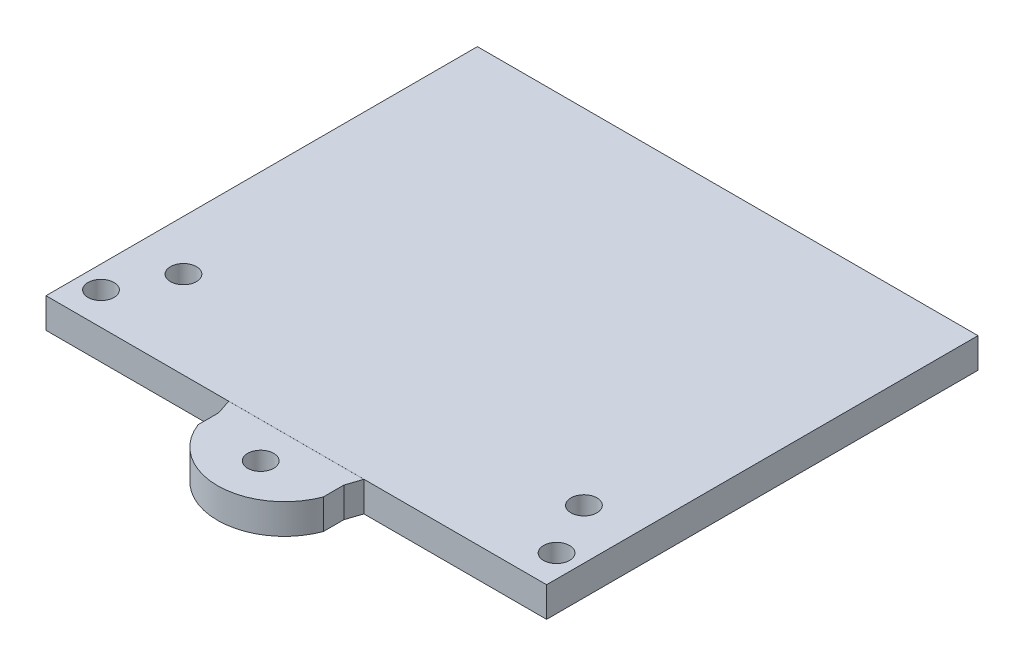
SolidWorks part; units mm, degrees
ref_plane "Front Plane" through (0, 0, 0) normal (0, 0, 1) x (1, 0, 0)
ref_plane "Top Plane" through (0, 0, 0) normal (0, 1, 0) x (1, 0, 0)
ref_plane "Right Plane" through (0, 0, 0) normal (1, 0, 0) x (0, 0, -1)
sketch "Sketch1" plane through (0, 0, 0) normal (0, 1, 0) x (1, 0, 0)
  line L0 (0, 3000) -> (0, -3000)
  line L1 (-50000, -172520.0043) -> (50000, -172520.0043)
  line L2 (-50000, -172520.0043) -> (-50000, -285980.011)
  line L3 (-50000, -285980.011) -> (50000, -285980.011)
  line L4 (50000, -172520.0043) -> (50000, -285980.011)
  line L5 (0, 3000) -> (0, -3000)
extrude "Boss-Extrude2" add sketch "Sketch1" against normal blind 6000 separate body contours L1 L4 L3 L2
ref_plane "Plane2" through (0, -6010, 0) normal (0, -1, 0) x (-1, 0, 0)
sketch "Sketch4" plane through (0, -6010, 0) normal (0, -1, 0) x (-1, 0, 0)
  line L0 (12500, -288980.011) -> (13500, -285980.011)
  line L2 (50000, -285980.011) -> (-50000, -285980.011) construction
  line L3 (12500, -288980.011) -> (12500, -293095.0012)
  line L4 (-13500, -285980.011) -> (-12500, -288980.011)
  line L6 (-12500, -288980.011) -> (-12500, -293095.0012)
  line L7 (13500, -285980.011) -> (-13500, -285980.011)
  circle A0 centre (0.0022, -293094.9951) radius 2600.0018
  arc A1 (12500, -293095.0012) -> (-12500, -293095.0012) centre (0, -288333.9769) cw
extrude "Boss-Extrude3" add sketch "Sketch4" against normal blind 6000
sketch "Sketch7" plane through (0, -6010, 0) normal (0, -1, 0) x (-1, 0, 0)
  circle A0 centre (45499.9956, -279495.0037) radius 2600.0002
  circle A1 centre (-45499.9999, -279495.0026) radius 2599.9983
  circle A2 centre (40000.0031, -268520.0043) radius 2600.0051
  circle A3 centre (-39999.9982, -268519.9929) radius 2600.0065
extrude "Cut-Extrude3" cut sketch "Sketch7" against normal blind 6500
scale "Scale1" bodies to scale 111 scale about origin uniform scaling yes scale factor 0.001
ref_plane "Plane3" through (0, 0, 172.52) normal (0, 0, -1) x (-1, 0, 0)
sketch "Sketch8" plane through (0, 0, 172.52) normal (0, 0, -1) x (-1, 0, 0)
  line L1 (-50, 0) -> (50, 0)
  line L2 (-50, 0) -> (-50, -6)
  line L3 (-50, -6) -> (50, -6)
  line L4 (50, 0) -> (50, -6)
extrude "Cut-Extrude4" cut sketch "Sketch8" against normal up to vertex (27.28 mm away)
